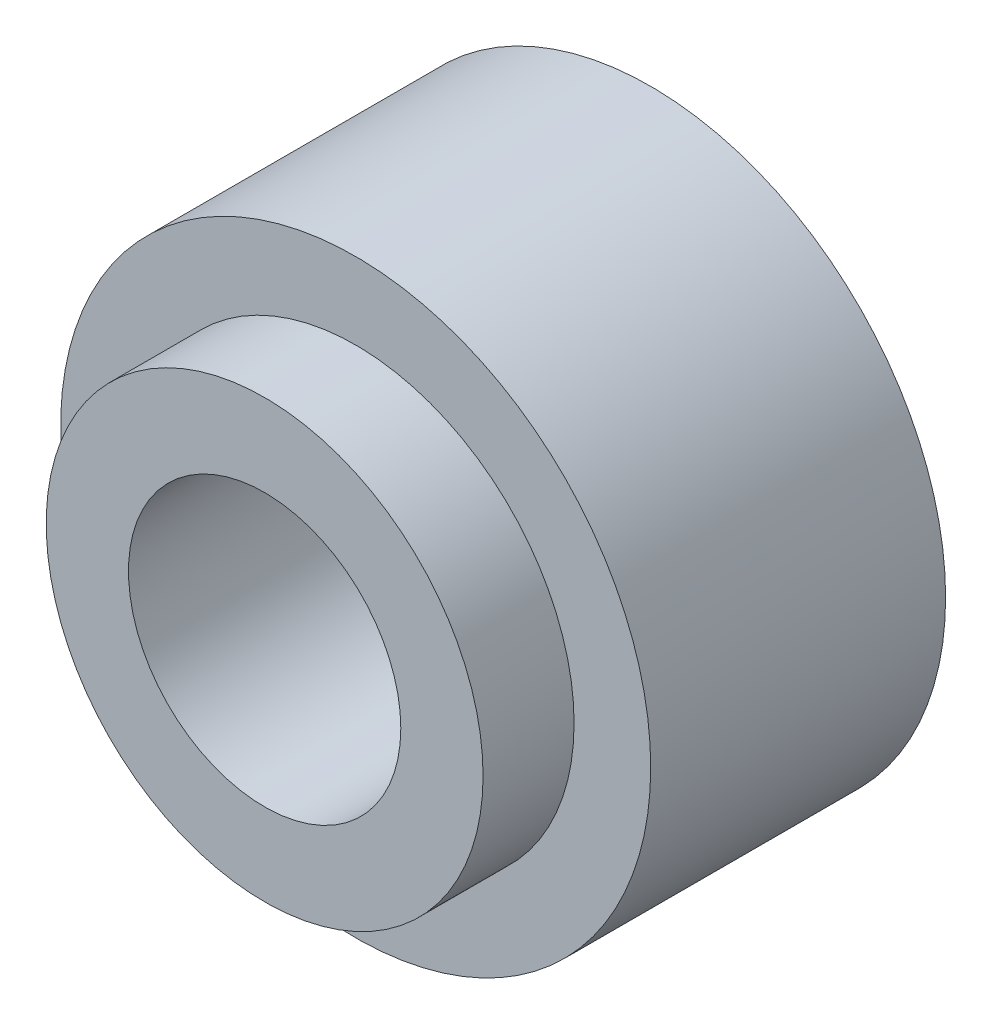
SolidWorks part; units mm, degrees
ref_plane "Front Plane" through (0, 0, 0) normal (0, 0, 1) x (1, 0, 0)
ref_plane "Top Plane" through (0, 0, 0) normal (0, 1, 0) x (1, 0, 0)
ref_plane "Right Plane" through (0, 0, 0) normal (1, 0, 0) x (0, 0, -1)
sketch "Sketch1" plane through (0, 0, 0) normal (0, 0, 1) x (1, 0, 0)
  circle A0 centre (0, 0) radius 10.2934
  dimension "D1" = 20.5867
extrude "Extrude1" add sketch "Sketch1" against normal blind 13.462
sketch "Sketch2" plane through (0, 0, 0) normal (0, 0, 1) x (1, 0, 0)
  circle A0 centre (0, 0) radius 7.62
  dimension "D1" = 15.24
extrude "Cut-Extrude1" cut sketch "Sketch2" against normal blind 3.175 contours A0 M2
sketch "Sketch3" plane through (0, 0, 0) normal (0, 0, 1) x (1, 0, 0)
  circle A0 centre (0, 0) radius 4.7498
  dimension "D1" = 9.4996
extrude "Cut-Extrude2" cut sketch "Sketch3" against normal through all
